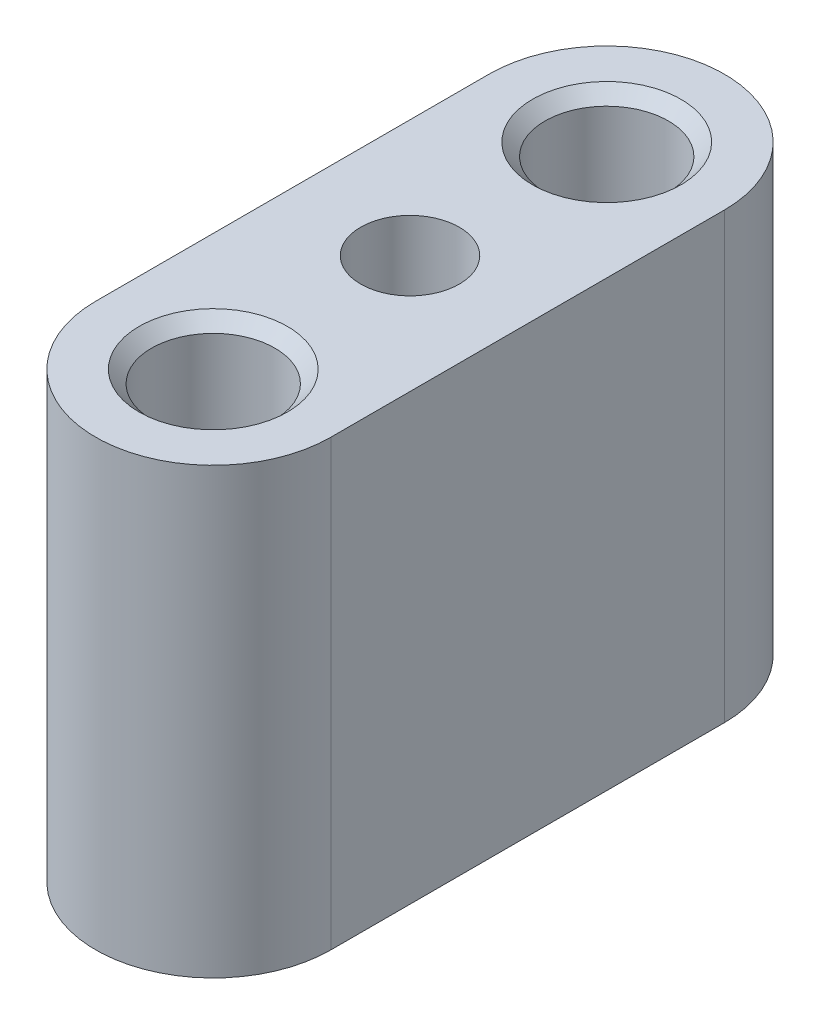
SolidWorks part; units mm, degrees
ref_plane "Front Plane" through (0, 0, 0) normal (0, 0, 1) x (1, 0, 0)
ref_plane "Top Plane" through (0, 0, 0) normal (0, 1, 0) x (1, 0, 0)
ref_plane "Right Plane" through (0, 0, 0) normal (1, 0, 0) x (0, 0, -1)
sketch "Sketch1" plane through (0, 0, 0) normal (0, 1, 0) x (1, 0, 0)
  line L0 (-2.385, 3.9878) -> (-2.385, -3.9878)
  line L1 (2.385, -3.9878) -> (2.385, 3.9878)
  line L2 (0, 3.9878) -> (0, -3.9878) construction
  arc A0 (-2.385, -3.9878) -> (2.385, -3.9878) centre (0, -3.9878) ccw
  arc A1 (2.385, 3.9878) -> (-2.385, 3.9878) centre (0, 3.9878) ccw
  dimension "D1" = 7.9756
  dimension "D2" = 4.77
extrude "Extrude1" add sketch "Sketch1" along normal blind 9
hole_wizard "M3x0.5 Tapped Hole1" positions "Sketch5" profile "Sketch4" tap size "M3x0.5" standard "ANSI Metric"
sketch "Sketch5" plane through (0, 9, 0) normal (0, 1, 0) x (1, 0, 0)
  line L0 (0, 3.9878) -> (0, -3.9878) construction
  arc A0 (2.385, 3.9878) -> (-2.385, 3.9878) centre (0, 3.9878) ccw construction
  point P0 (0, -3.9878)
  point P2 (0, 3.9878)
sketch "Sketch4" plane through (0, 9, 3.9878) normal (1, 0, 0) x (0, 0, 1)
  line L0 (0, 0) -> (0, 7.2535)
  line L1 (0, 7.2535) -> (1.25, 6.5024)
  line L2 (1.25, 6.5024) -> (1.25, 0)
  line L5 (1.25, 0) -> (0, 0)
  line L10 (0, 7.2535) -> (-1.25, 6.5024) construction
  line L11 (0, -6.35) -> (0, 107.95) construction
  dimension "Tap Drill Dia." = 2.5
  dimension "Tap Drill Depth" = 6.5024
  dimension "Drill Angle" = 118
hole_wizard "Hole1" positions "Sketch7" profile "Sketch6" legacy
sketch "Sketch7" plane through (0, 9, 0) normal (0, 1, 0) x (1, 0, 0)
  point P0 (0, 0)
sketch "Sketch6" plane through (0, 9, 0) normal (1, 0, 0) x (0, 0, 1)
  line L0 (0, 0) -> (0, 9.6009)
  line L1 (0, 9.6009) -> (1, 9)
  line L2 (1, 9) -> (1, 0)
  line L4 (1, 0) -> (0, 0)
  line L6 (0, 9.6009) -> (-1, 9) construction
  line L7 (0, -4.2442) -> (0, 117.3081) construction
  dimension "Diameter" = 2
  dimension "Depth" = 9
  dimension "Drill Angle" = 118
chamfer "Chamfer1" distance 0.254 angle 45 2 edges at (0, 9, -2.7378) (0, 9, 5.2378)
